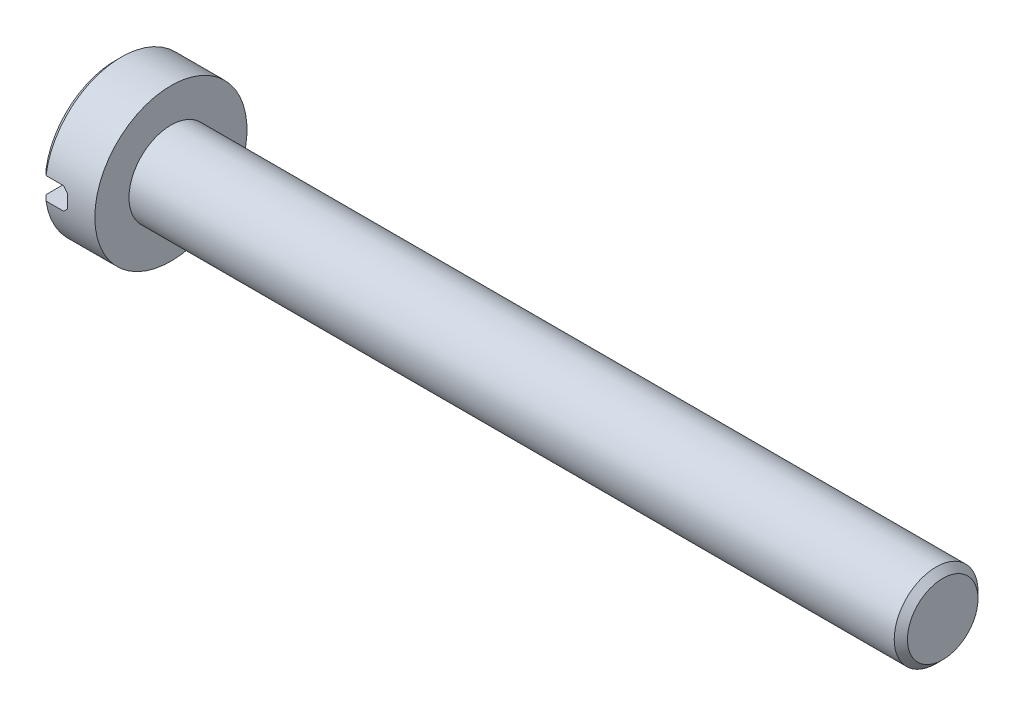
SolidWorks part; units mm, degrees
ref_plane "Face" through (0, 0, 0) normal (0, 0, 1) x (1, 0, 0)
ref_plane "Dessus" through (0, 0, 0) normal (0, 1, 0) x (1, 0, 0)
ref_plane "Droite" through (0, 0, 0) normal (1, 0, 0) x (0, 0, -1)
sketch "Esquisse1" plane through (0, 0, 0) normal (0, 0, 1) x (1, 0, 0)
  line L0 (0, 0) -> (0, 3.2)
  line L1 (0.25, 3.45) -> (2.5, 3.45)
  line L2 (2.5, 3.45) -> (2.5, 0)
  line L5 (0, 0) -> (7.6423, 0) construction
  line L7 (0, 3.2) -> (0.25, 3.45)
  line L8 (0, 0) -> (2.5, 0)
  point P1 (0, 3.45)
  dimension "D1" = 3.45
  dimension "D3" = 2.5
revolve "Révolution1" add sketch "Esquisse1" angle 360 about L5
sketch "Esquisse2" plane through (0, 0, 0) normal (0, 0, 1) x (1, 0, 0)
  line L0 (0, 3.2) -> (0, -3.2) construction
  line L1 (0, 0.5) -> (1.05, 0.5)
  line L2 (0, 0.5) -> (0, -0.5)
  line L3 (0, -0.5) -> (1.05, -0.5)
  line L4 (1.25, 0.3) -> (1.25, -0.3)
  line L5 (1.05, 0.5) -> (1.25, 0.3)
  line L6 (1.05, -0.5) -> (1.25, -0.3)
  point P1 (1.25, -0.5)
  point P3 (1.25, 0.5)
  dimension "D1" = 1.25
  dimension "D2" = 1
extrude "Enlèv. mat.-Extru.1" cut sketch "Esquisse2" against normal mid plane 10
sketch "Esquisse3" plane through (2.5, 0, 0) normal (1, 0, 0) x (0, 0, -1)
  circle A0 centre (0, 0) radius 1.9
extrude "Extrusion1" add sketch "Esquisse3" along normal blind 35
chamfer "Chanfrein1" distance 0.3 angle 45 1 edges at (37.5, 0, -1.9)
